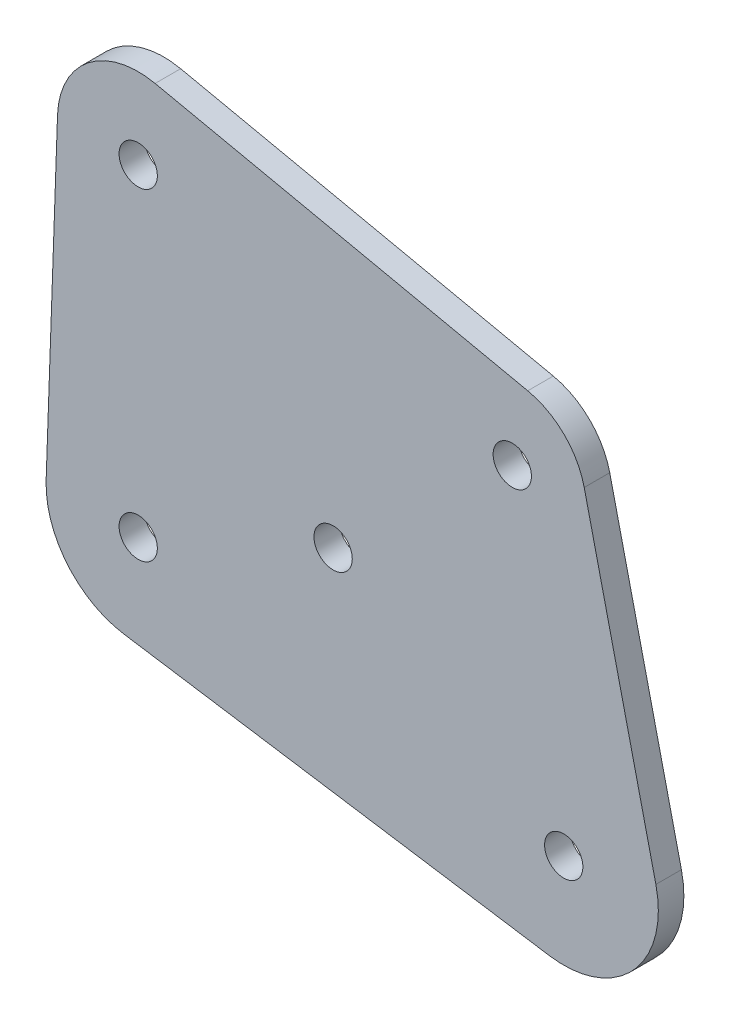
SolidWorks part; units mm, degrees
ref_plane "Front" through (0, 0, 0) normal (0, 0, 1) x (1, 0, 0)
ref_plane "Top" through (0, 0, 0) normal (0, 1, 0) x (1, 0, 0)
ref_plane "Right" through (0, 0, 0) normal (1, 0, 0) x (0, 0, -1)
sketch "Sketch1" plane through (0, 0, 0) normal (0, 0, 1) x (1, 0, 0)
  line L1 (1219.2, 914.4) -> (0, 914.4)
  line L2 (1219.2, 914.4) -> (1219.2, 0)
  line L3 (1219.2, 0) -> (0, 0)
  line L4 (0, 914.4) -> (0, 0)
  dimension "D1" = 1219.2
  dimension "D2" = 914.4
extrude "Extrude1" add sketch "Sketch1" along normal blind 25.4
sketch "Sketch2" plane through (0, 0, 25.4) normal (0, 0, 1) x (1, 0, 0)
  circle A0 centre (325.835, 644.0183) radius 19.05
  circle A1 centre (697.9414, 571.2371) radius 19.05
  circle A2 centre (519.7364, 410.9934) radius 19.05
  circle A3 centre (749.1306, 260.2344) radius 19.05
  circle A4 centre (325.835, 323.1669) radius 19.05
  dimension "D1" = 38.1
extrude "Cut-Extrude1" cut sketch "Sketch2" against normal through all
sketch "Sketch3" plane through (0, 0, 25.4) normal (0, 0, 1) x (1, 0, 0)
  line L0 (245.5909, 646.8606) -> (234.2404, 326.4112)
  line L1 (311.8343, 232.5905) -> (734.7529, 167.2187)
  line L2 (840.8015, 281.5672) -> (769.516, 587.8933)
  line L3 (713.3402, 643.0927) -> (342.6602, 722.5301)
  arc A0 (342.6602, 722.5301) -> (245.5909, 646.8606) centre (325.835, 644.0183) ccw
  arc A1 (234.2404, 326.4112) -> (311.8343, 232.5905) centre (325.835, 323.1669) ccw
  arc A2 (734.7529, 167.2187) -> (840.8015, 281.5672) centre (749.1306, 260.2344) ccw
  arc A3 (769.516, 587.8933) -> (713.3402, 643.0927) centre (697.9414, 571.2371) ccw
  circle A4 centre (325.835, 323.1669) radius 19.05 construction
  circle A5 centre (749.1306, 260.2344) radius 19.05 construction
  circle A6 centre (697.9414, 571.2371) radius 19.05 construction
extrude "Cut-Extrude2" cut sketch "Sketch3" against normal through all flip side to cut
